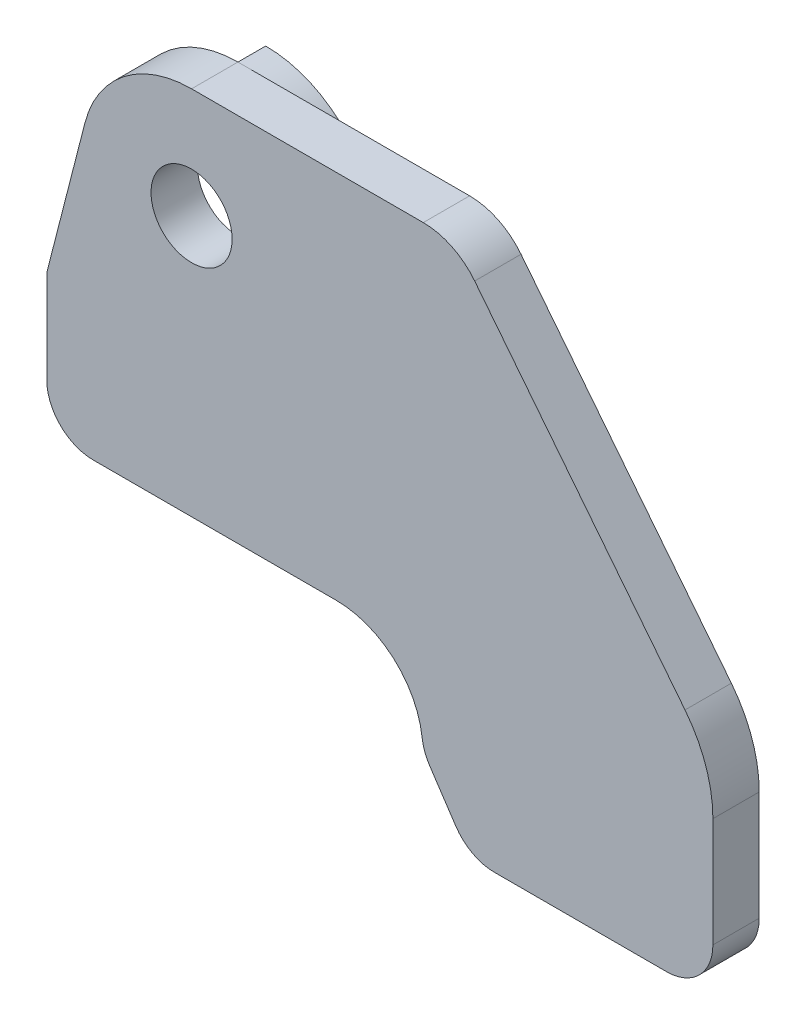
SolidWorks part; units mm, degrees
ref_plane "Front Plane" through (0, 0, 0) normal (0, 0, 1) x (1, 0, 0)
ref_plane "Top Plane" through (0, 0, 0) normal (0, 1, 0) x (1, 0, 0)
ref_plane "Right Plane" through (0, 0, 0) normal (1, 0, 0) x (0, 0, -1)
sketch "Sketch1" plane through (0, 0, 0) normal (0, 0, 1) x (1, 0, 0)
  line L0 (-5.8433, 1.4991) -> (-7.9375, -6.6637)
  line L1 (-7.9375, -6.6637) -> (-7.9375, -14.2837)
  line L2 (-7.9375, -14.2837) -> (7.9375, -14.2837)
  line L3 (0, 6.0325) -> (12.7, 6.0325)
  line L4 (15.518, 4.6673) -> (27.0475, -9.929)
  line L5 (28.575, -14.3272) -> (28.575, -22.86)
  line L6 (28.575, -22.86) -> (15.24, -22.86)
  line L7 (15.24, -22.86) -> (12.674, -19.0109)
  circle A0 centre (0, 0) radius 2.2225
  arc A1 (-5.8433, 1.4991) -> (0, 6.0325) centre (0, 0) cw
  arc A2 (12.7, 6.0325) -> (15.518, 4.6673) centre (12.7, 2.4414) cw
  arc A3 (27.0475, -9.929) -> (28.575, -14.3272) centre (21.4794, -14.3272) cw
  arc A4 (12.674, -19.0109) -> (7.9375, -14.2837) centre (7.9375, -19.0202) ccw
  point P6 (-3.6978, 4.7663)
  dimension "D1" = 6.0325
  dimension "D5" = 12.7
  dimension "D6" = 4.445
  dimension "D2" = 19.05
  dimension "D3" = 7.62
  dimension "D4" = 7.9375
  dimension "D7" = 28.575
  dimension "D8" = 22.86
  dimension "D9" = 15.24
  dimension "D10" = 15.875
extrude "Boss-Extrude1" add sketch "Sketch1" along normal blind 2.54
fillet "Fillet1" radius 2.54 4 edges at (-7.9375, -14.2837, 1.27) (28.575, -22.86, 1.27) (15.24, -22.86, 1.27) (12.674, -19.0109, 1.27)
sketch "Sketch2" plane through (0, 0, 0) normal (0, 0, -1) x (-1, 0, 0)
  line L0 (0, 6.0325) -> (0, 3.2656)
  line L1 (-12.7, 6.0325) -> (0, 6.0325) construction
  line L2 (-3.2385, 0.5715) -> (-6.0054, 0.5715)
  line L3 (7.9375, -6.6637) -> (7.9375, -11.7437) construction
  arc A1 (0, 3.2656) -> (-3.2385, 0.5715) centre (-0.0438, 0.0247) ccw
  arc A2 (-6.0054, 0.5715) -> (0, 6.0325) centre (0, 0) cw
  dimension "D1" = 5.461
  dimension "D2" = 11.176
extrude "Boss-Extrude2" add sketch "Sketch2" along normal blind 1.524
